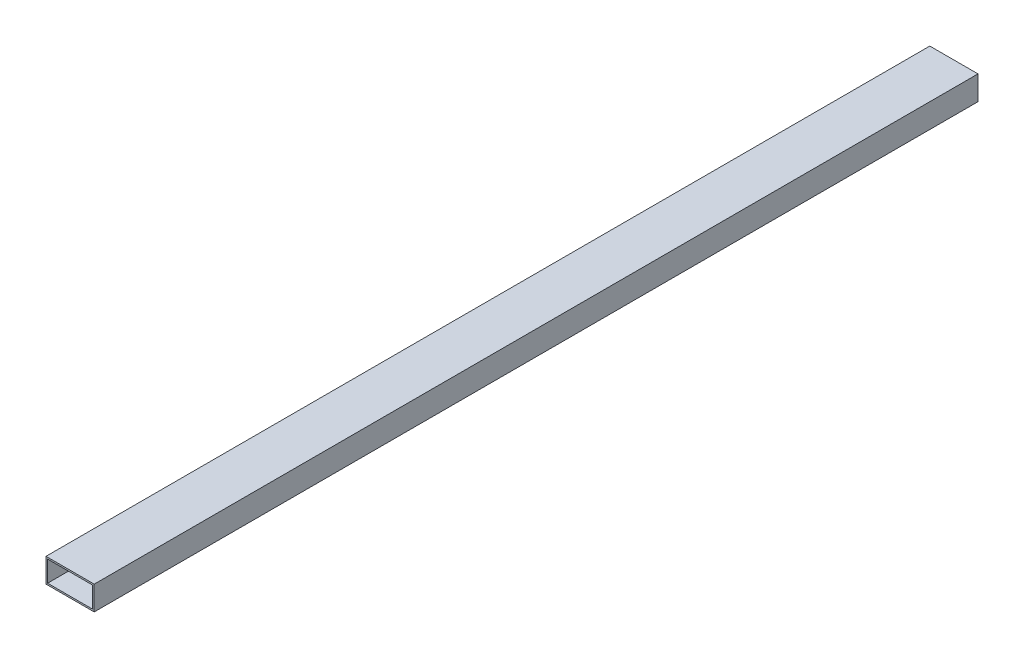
SolidWorks part; units mm, degrees
ref_plane "Plan de face" through (0, 0, 0) normal (0, 0, 1) x (1, 0, 0)
ref_plane "Plan de dessus" through (0, 0, 0) normal (0, 1, 0) x (1, 0, 0)
ref_plane "Plan de droite" through (0, 0, 0) normal (1, 0, 0) x (0, 0, -1)
sketch "Esquisse1" plane through (0, 0, 0) normal (0, 0, 1) x (1, 0, 0)
  line L0 (-32.7851, 0) -> (47.4143, 0) construction
  line L1 (-30, 15) -> (30, 15)
  line L2 (-30, 15) -> (-30, -15)
  line L3 (-30, -15) -> (30, -15)
  line L4 (30, 15) -> (30, -15)
  line L5 (0, 21.8132) -> (0, -24.1643) construction
  dimension "D1" = 60
  dimension "D2" = 30
extrude "Extru.-Mince1" add sketch "Esquisse1" along normal blind 1100 thin
sketch "Esquisse3" plane through (0, -15, 0) normal (0, -1, 0) x (1, 0, 0)
  line L0 (0, -40.5099) -> (0, 96.0173) construction
  line L1 (-30, 0) -> (30, 0) construction
  circle A0 centre (0, 50) radius 12.5
  dimension "D1" = 25
  dimension "D2" = 50
extrude "Extrusion2" cut sketch "Esquisse3" against normal blind 10
